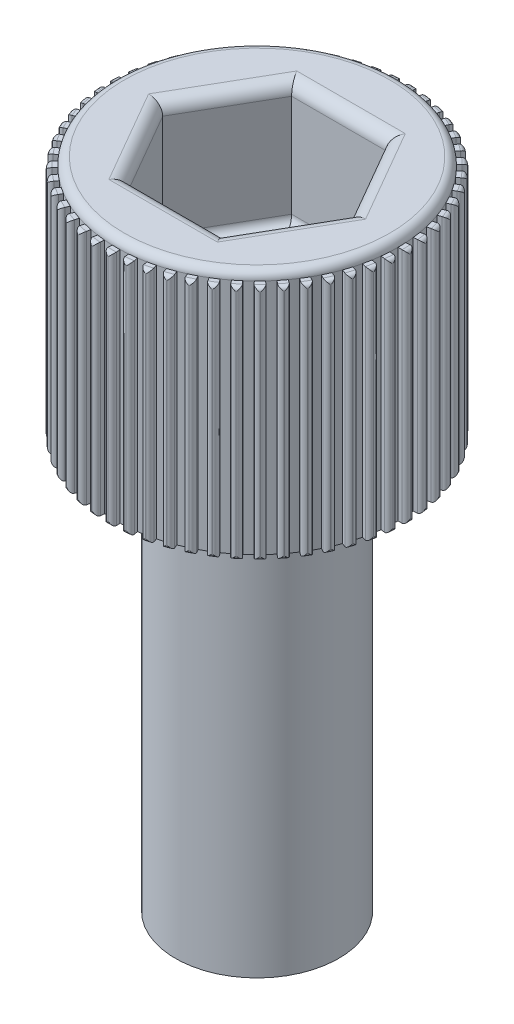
SolidWorks part; units mm, degrees
ref_plane "Front Plane" through (0, 0, 0) normal (0, 0, 1) x (1, 0, 0)
ref_plane "Top Plane" through (0, 0, 0) normal (0, 1, 0) x (1, 0, 0)
ref_plane "Right Plane" through (0, 0, 0) normal (1, 0, 0) x (0, 0, -1)
sketch "Sketch1" plane through (0, 0, 0) normal (0, 0, 1) x (1, 0, 0)
  line L0 (0, 0) -> (0, 57.5065) construction
  line L1 (0, 0) -> (2.54, 0)
  line L2 (2.54, 0) -> (2.54, 12.7)
  line L3 (2.54, 12.7) -> (4.6355, 12.7)
  line L4 (4.6355, 12.7) -> (4.6355, 20.32)
  line L5 (4.6355, 20.32) -> (0, 20.32)
  line L6 (0, 20.32) -> (0, 0)
  dimension "D1" = 2.54
  dimension "D2" = 12.7
  dimension "D3" = 20.32
  dimension "D4" = 4.6355
revolve "Revolve1" add sketch "Sketch1" angle 360 about L0
sketch "Sketch2" plane through (0, 20.32, 0) normal (0, 1, 0) x (-1, 0, 0)
  line L1 (-2.9329, 0) -> (-1.4665, -2.54)
  line L2 (-1.4665, -2.54) -> (1.4665, -2.54)
  line L3 (1.4665, -2.54) -> (2.9329, 0)
  line L4 (2.9329, 0) -> (1.4665, 2.54)
  line L5 (1.4665, 2.54) -> (-1.4665, 2.54)
  line L6 (-1.4665, 2.54) -> (-2.9329, 0)
  circle A0 centre (0, 0) radius 2.54 construction
  dimension "D1" = 5.08
extrude "Cut-Extrude1" cut sketch "Sketch2" against normal blind 3.81
sketch "Sketch3" plane through (0, 20.32, 0) normal (0, 1, 0) x (-1, 0, 0)
  circle A0 centre (0, 0) radius 4.6355
  circle A1 centre (0, 0) radius 4.3815
  circle A2 centre (0, 0) radius 4.6355 construction
  dimension "D1" = 0.254
extrude "Cut-Extrude2" cut sketch "Sketch3" against normal blind 0.254
fillet "Fillet1" radius 0.254 1 edges at (0, 20.32, 4.3815)
sketch "Sketch4" plane through (0, 20.066, 0) normal (0, 1, 0) x (1, 0, 0)
  line L0 (-0.127, 4.3797) -> (-0.127, 4.8877)
  line L1 (-0.127, 4.8877) -> (0.127, 4.8877)
  line L2 (0.127, 4.8877) -> (0.127, 4.3797)
  circle A0 centre (0, 0) radius 4.3815
  dimension "D3" = 8.763
  dimension "D2" = 0.508
  dimension "D1" = 0.254
extrude "Cut-Extrude3" cut sketch "Sketch4" against normal through all contours L2 L0 M3 M2 | L2 L1 L0 M3
pattern_circular "CirPattern1" count 55 over 360 about axis through (0, 0, 0) along (0, 1, 0) of "Cut-Extrude3"
fillet "Fillet2" radius 0.127 116 edges at (0.9258, 16.383, -4.5421) (0.7905, 20.066, -4.5676) (0.6544, 16.383, -4.5891) (0.7905, 12.7, -4.5676) (1.4376, 16.383, -4.407) (1.306, 20.066, -4.4477) (1.1732, 16.383, -4.4846) (1.306, 12.7, -4.4477) (1.9305, 16.383, -4.2144) (1.8045, 20.066, -4.2699) (1.6768, 16.383, -4.3216) (1.8045, 12.7, -4.2699) (2.3984, 16.383, -3.9668) (2.2794, 20.066, -4.0363) (2.1585, 16.383, -4.1023) (2.2794, 12.7, -4.0363) (2.8349, 16.383, -3.6676) (2.7247, 20.066, -3.7502) (2.612, 16.383, -3.8295) (2.7247, 12.7, -3.7502) (3.2345, 16.383, -3.3205) (3.1344, 20.066, -3.4152) (3.0315, 16.383, -3.5068) (3.1344, 12.7, -3.4152) (3.5919, 16.383, -2.9302) (3.5033, 20.066, -3.0356) (3.4115, 16.383, -3.1384) (3.5033, 12.7, -3.0356) (3.9025, 16.383, -2.5016) (3.8265, 20.066, -2.6165) (3.747, 16.383, -2.729) (3.8265, 12.7, -2.6165) (4.1623, 16.383, -2.0405) (4.0998, 20.066, -2.1632) (4.0337, 16.383, -2.2841) (4.0998, 12.7, -2.1632) (4.3677, 16.383, -1.5527) (4.3197, 20.066, -1.6818) (4.2678, 16.383, -1.8094) (4.3197, 12.7, -1.6818) (4.5162, 16.383, -1.0447) (4.4832, 20.066, -1.1784) (4.4462, 16.383, -1.3111) (4.4832, 12.7, -1.1784) (4.6059, 16.383, -0.5231) (4.5883, 20.066, -0.6597) (4.5667, 16.383, -0.7958) (4.5883, 12.7, -0.6597) (4.6355, 16.383, 0.0054) (4.6336, 20.066, -0.1324) (4.6276, 16.383, -0.27) (4.6336, 12.7, -0.1324) (4.6047, 16.383, 0.5337) (4.6185, 20.066, 0.3967) (4.6282, 16.383, 0.2593) (4.6185, 12.7, 0.3967) (4.5138, 16.383, 1.0552) (4.5432, 20.066, 0.9206) (4.5685, 16.383, 0.7852) (4.5432, 12.7, 0.9206) (4.3641, 16.383, 1.5628) (4.4086, 20.066, 1.4324) (4.4492, 16.383, 1.3008) (4.4086, 12.7, 1.4324) (4.1575, 16.383, 2.0501) (4.2166, 20.066, 1.9257) (4.272, 16.383, 1.7995) (4.2166, 12.7, 1.9257) (3.8967, 16.383, 2.5107) (3.9696, 20.066, 2.3938) (4.039, 16.383, 2.2747) (3.9696, 12.7, 2.3938) (3.5851, 16.383, 2.9385) (3.6709, 20.066, 2.8307) (3.7534, 16.383, 2.7203) (3.6709, 12.7, 2.8307) (3.2268, 16.383, 3.328) (3.3243, 20.066, 3.2307) (3.4188, 16.383, 3.1304) (3.3243, 12.7, 3.2307) (2.8264, 16.383, 3.6741) (2.9343, 20.066, 3.5885) (3.0397, 16.383, 3.4998) (2.9343, 12.7, 3.5885) (2.3892, 16.383, 3.9724) (2.5061, 20.066, 3.8996) (2.6209, 16.383, 3.8234) (2.5061, 12.7, 3.8996) (1.9208, 16.383, 4.2188) (2.0453, 20.066, 4.1599) (2.168, 16.383, 4.0973) (2.0453, 12.7, 4.1599) (1.4273, 16.383, 4.4103) (1.5578, 20.066, 4.3659) (1.6868, 16.383, 4.3177) (1.5578, 12.7, 4.3659) (0.9153, 16.383, 4.5442) (1.0499, 20.066, 4.515) (1.1836, 16.383, 4.4818) (1.0499, 12.7, 4.515) (0.3913, 16.383, 4.619) (0.5284, 20.066, 4.6053) (0.665, 16.383, 4.5875) (0.5284, 12.7, 4.6053) (-0.1377, 16.383, 4.6335) (0, 20.066, 4.6355) (0.1377, 16.383, 4.6335) (0, 12.7, 4.6355) (-0.665, 16.383, 4.5875) (-0.5284, 20.066, 4.6053) (-0.3913, 16.383, 4.619) (-0.5284, 12.7, 4.6053) (-1.1836, 16.383, 4.4818) (-1.0499, 20.066, 4.515) (-0.9153, 16.383, 4.5442) (-1.0499, 12.7, 4.515)
fillet "Fillet3" radius 0.127 104 edges at (-1.6868, 16.383, 4.3177) (-1.5578, 20.066, 4.3659) (-1.4273, 16.383, 4.4103) (-1.5578, 12.7, 4.3659) (-2.168, 16.383, 4.0973) (-2.0453, 20.066, 4.1599) (-1.9208, 16.383, 4.2188) (-2.0453, 12.7, 4.1599) (-2.6209, 16.383, 3.8234) (-2.5061, 20.066, 3.8996) (-2.3892, 16.383, 3.9724) (-2.5061, 12.7, 3.8996) (-3.0397, 16.383, 3.4998) (-2.9343, 20.066, 3.5885) (-2.8264, 16.383, 3.6741) (-2.9343, 12.7, 3.5885) (-3.4188, 16.383, 3.1304) (-3.3243, 20.066, 3.2307) (-3.2268, 16.383, 3.328) (-3.3243, 12.7, 3.2307) (-3.7534, 16.383, 2.7203) (-3.6709, 20.066, 2.8307) (-3.5851, 16.383, 2.9385) (-3.6709, 12.7, 2.8307) (-4.039, 16.383, 2.2747) (-3.9696, 20.066, 2.3938) (-3.8967, 16.383, 2.5107) (-3.9696, 12.7, 2.3938) (-4.272, 16.383, 1.7995) (-4.2166, 20.066, 1.9257) (-4.1575, 16.383, 2.0501) (-4.2166, 12.7, 1.9257) (-4.4492, 16.383, 1.3008) (-4.4086, 20.066, 1.4324) (-4.3641, 16.383, 1.5628) (-4.4086, 12.7, 1.4324) (-4.5685, 16.383, 0.7852) (-4.5432, 20.066, 0.9206) (-4.5138, 16.383, 1.0552) (-4.5432, 12.7, 0.9206) (-4.6282, 16.383, 0.2593) (-4.6185, 20.066, 0.3967) (-4.6047, 16.383, 0.5337) (-4.6185, 12.7, 0.3967) (-4.6276, 16.383, -0.27) (-4.6336, 20.066, -0.1324) (-4.6355, 16.383, 0.0054) (-4.6336, 12.7, -0.1324) (-4.5667, 16.383, -0.7958) (-4.5883, 20.066, -0.6597) (-4.6059, 16.383, -0.5231) (-4.5883, 12.7, -0.6597) (-4.4462, 16.383, -1.3111) (-4.4832, 20.066, -1.1784) (-4.5162, 16.383, -1.0447) (-4.4832, 12.7, -1.1784) (-4.2678, 16.383, -1.8094) (-4.3197, 20.066, -1.6818) (-4.3677, 16.383, -1.5527) (-4.3197, 12.7, -1.6818) (-4.0337, 16.383, -2.2841) (-4.0998, 20.066, -2.1632) (-4.1623, 16.383, -2.0405) (-4.0998, 12.7, -2.1632) (-3.747, 16.383, -2.729) (-3.8265, 20.066, -2.6165) (-3.9025, 16.383, -2.5016) (-3.8265, 12.7, -2.6165) (-3.4115, 16.383, -3.1384) (-3.5033, 20.066, -3.0356) (-3.5919, 16.383, -2.9302) (-3.5033, 12.7, -3.0356) (-3.0315, 16.383, -3.5068) (-3.1344, 20.066, -3.4152) (-3.2345, 16.383, -3.3205) (-3.1344, 12.7, -3.4152) (-2.612, 16.383, -3.8295) (-2.7247, 20.066, -3.7502) (-2.8349, 16.383, -3.6676) (-2.7247, 12.7, -3.7502) (-2.1585, 16.383, -4.1023) (-2.2794, 20.066, -4.0363) (-2.3984, 16.383, -3.9668) (-2.2794, 12.7, -4.0363) (-1.6768, 16.383, -4.3216) (-1.8045, 20.066, -4.2699) (-1.9305, 16.383, -4.2144) (-1.8045, 12.7, -4.2699) (-1.1732, 16.383, -4.4846) (-1.306, 20.066, -4.4477) (-1.4376, 16.383, -4.407) (-1.306, 12.7, -4.4477) (-0.6544, 16.383, -4.5891) (-0.7905, 20.066, -4.5676) (-0.9258, 16.383, -4.5421) (-0.7905, 12.7, -4.5676) (-0.127, 16.383, -4.6338) (-0.2646, 20.066, -4.6279) (-0.402, 16.383, -4.618) (-0.2646, 12.7, -4.6279) (0.127, 16.383, -4.6338) (0.2646, 12.7, -4.6279) (0.402, 16.383, -4.618) (0.2646, 20.066, -4.6279)
fillet "Fillet5" radius 0.254 6 edges at (0, 16.51, 2.54) (-2.1997, 16.51, 1.27) (-2.1997, 16.51, -1.27) (0, 16.51, -2.54) (2.1997, 16.51, -1.27) (2.1997, 16.51, 1.27)
fillet "Fillet6" radius 0.381 6 edges at (2.1997, 20.32, 1.27) (0, 20.32, 2.54) (-2.1997, 20.32, 1.27) (-2.1997, 20.32, -1.27) (0, 20.32, -2.54) (2.1997, 20.32, -1.27)
